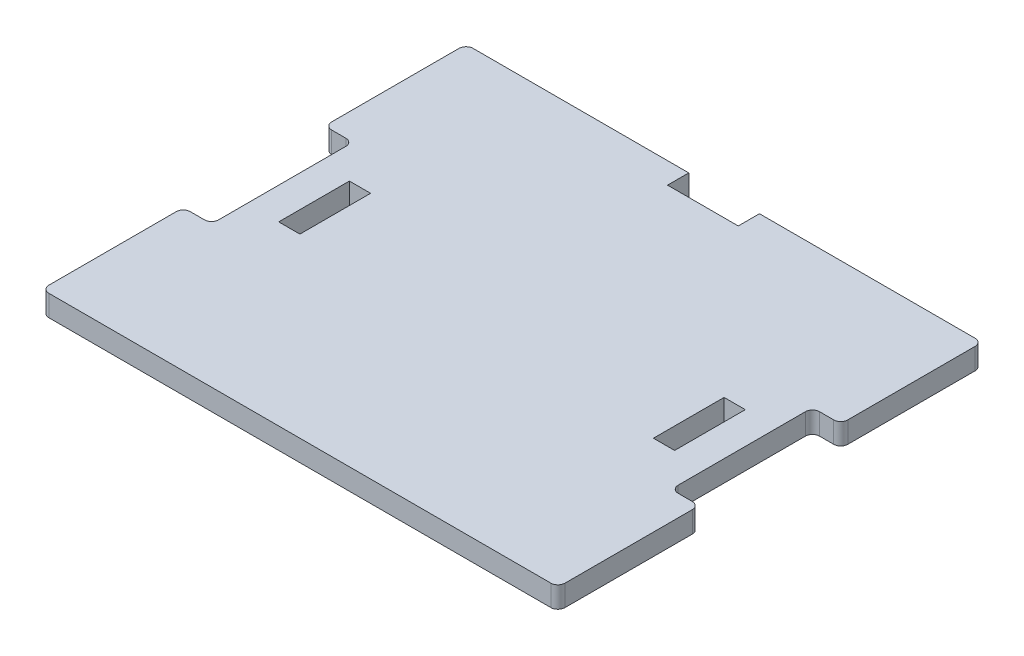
SolidWorks part; units mm, degrees
ref_plane "Front Plane" through (0, 0, 0) normal (0, 0, 1) x (1, 0, 0)
ref_plane "Top Plane" through (0, 0, 0) normal (0, 1, 0) x (1, 0, 0)
ref_plane "Right Plane" through (0, 0, 0) normal (1, 0, 0) x (0, 0, -1)
sketch "Sketch1" plane through (0, 0, 0) normal (0, 1, 0) x (1, 0, 0)
  line L0 (-65, 20) -> (-65, -20)
  line L1 (-65, 20) -> (-73, 20)
  line L2 (-73, 20) -> (-73, 60)
  line L3 (-73, 60) -> (73, 60)
  line L4 (0, 0) -> (0, 60) construction
  line L5 (0, 0) -> (-65, 0) construction
  line L6 (-65, -20) -> (-73, -20)
  line L7 (-73, -20) -> (-73, -60)
  line L8 (-73, -60) -> (73, -60)
  line L9 (-73, 60) -> (73, 60)
  line L10 (-73, 20) -> (-73, 60)
  line L11 (-65, 20) -> (-73, 20)
  line L12 (-73, -60) -> (73, -60)
  line L13 (-73, -20) -> (-73, -60)
  line L14 (-65, -20) -> (-73, -20)
  line L15 (-65, -20) -> (-73, -20)
  line L16 (-65, -20) -> (-73, -20)
  line L17 (-73, -20) -> (-73, -60)
  line L18 (-73, -60) -> (73, -60)
  line L19 (-73, -60) -> (73, -60)
  line L20 (-73, -20) -> (-73, -60)
  line L21 (-65, 20) -> (-73, 20)
  line L22 (-73, 20) -> (-73, 60)
  line L23 (-73, 60) -> (73, 60)
  line L24 (-73, 60) -> (73, 60)
  line L25 (-73, 20) -> (-73, 60)
  line L26 (-65, 20) -> (-73, 20)
  line L27 (65, 20) -> (73, 20)
  line L28 (73, 20) -> (73, 60)
  line L29 (73, 20) -> (73, 60)
  line L30 (65, 20) -> (73, 20)
  line L31 (73, -20) -> (73, -60)
  line L32 (73, -20) -> (73, -60)
  line L33 (65, -20) -> (73, -20)
  line L34 (65, -20) -> (73, -20)
  line L35 (65, -20) -> (73, -20)
  line L36 (73, -20) -> (73, -60)
  line L37 (65, 20) -> (73, 20)
  line L38 (73, 20) -> (73, 60)
  line L39 (73, -20) -> (73, -60)
  line L40 (65, -20) -> (73, -20)
  line L41 (73, 20) -> (73, 60)
  line L42 (65, 20) -> (73, 20)
  line L43 (65, 20) -> (65, -20)
  line L44 (-73, -60) -> (73, -60)
  point P2 (-65, 0)
  point P19 (0, -60)
  dimension "D1" = 65
  dimension "D2" = 40
  dimension "D3" = 8
  dimension "D4" = 120
extrude "Boss-Extrude1" add sketch "Sketch1" along normal blind 6 contours L43 L27 L28 L3 L2 L1 L0 L6 L7 L8 L31 L33
fillet "Fillet1" radius 2 12 edges at (-73, 3, -20) (-65, 3, -20) (-73, 3, -60) (-73, 3, 20) (-65, 3, 20) (-73, 3, 60) (73, 3, 60) (73, 3, -60) (73, 3, -20) (73, 3, 20) (65, 3, 20) (65, 3, -20)
sketch "Sketch2" plane through (0, 6, 0) normal (0, 1, 0) x (1, 0, 0)
  line L0 (0, 0) -> (0, 60) construction
  line L1 (50, 10) -> (56, 10)
  line L2 (50, 10) -> (50, -10)
  line L3 (50, -10) -> (56, -10)
  line L4 (56, 10) -> (56, -10)
  line L5 (-71, 60) -> (71, 60) construction
  line L6 (-50, -10) -> (-56, -10)
  line L7 (-56, 10) -> (-56, -10)
  line L8 (-50, 10) -> (-56, 10)
  line L9 (-50, 10) -> (-50, -10)
  point P9 (50, 0)
  dimension "D1" = 20
  dimension "D2" = 6
  dimension "D3" = 50
extrude "Cut-Extrude1" cut sketch "Sketch2" against normal through all and the other way through all
sketch "Sketch3" plane through (0, 6, 0) normal (0, 1, 0) x (1, 0, 0)
  line L0 (0, 60) -> (0, 33.7324) construction
  line L1 (-71, 60) -> (71, 60) construction
  line L3 (-10, 60) -> (10, 60)
  line L4 (-10, 60) -> (-10, 54)
  line L5 (-10, 54) -> (10, 54)
  line L6 (10, 60) -> (10, 54)
  point P9 (0, 54)
  dimension "D1" = 6
  dimension "D2" = 20
extrude "Cut-Extrude2" cut sketch "Sketch3" against normal through all
